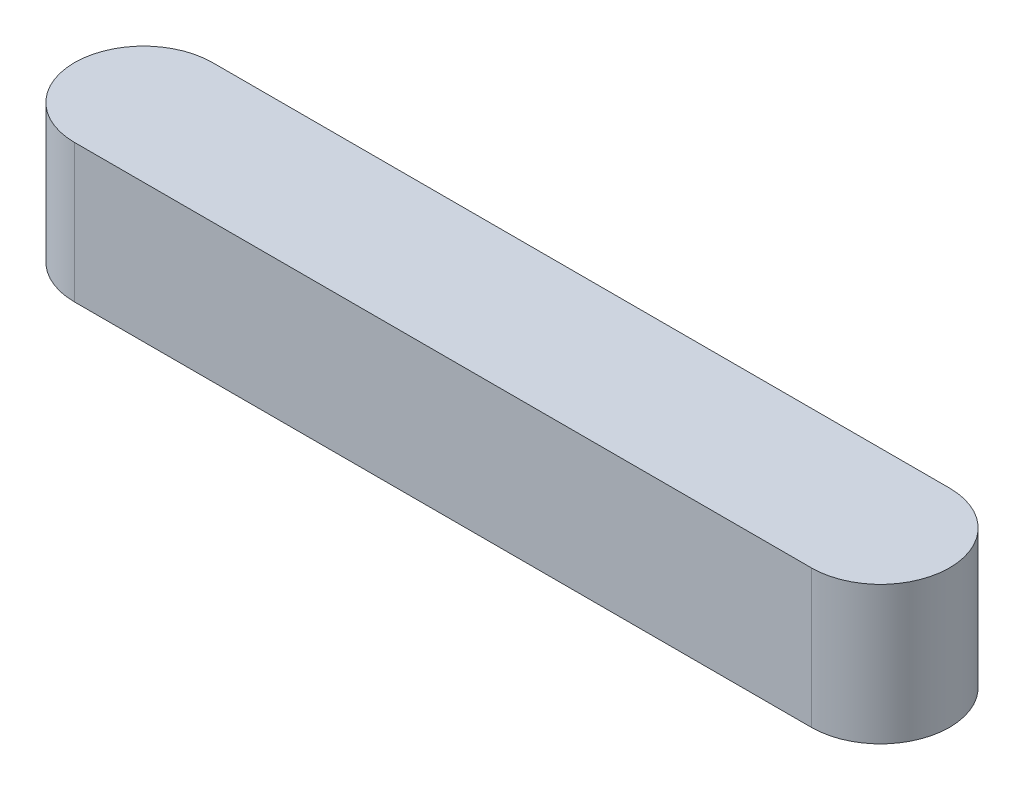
SolidWorks part; units mm, degrees
ref_plane "Plan de face" through (0, 0, 0) normal (0, 0, 1) x (1, 0, 0)
ref_plane "Plan de dessus" through (0, 0, 0) normal (0, 1, 0) x (1, 0, 0)
ref_plane "Plan de droite" through (0, 0, 0) normal (1, 0, 0) x (0, 0, -1)
sketch "Esquisse1" plane through (0, 0, 0) normal (0, 1, 0) x (1, 0, 0)
  line L0 (0, 3) -> (32, 3)
  line L1 (0, -3) -> (32, -3)
  arc A0 (0, 3) -> (0, -3) centre (0, 0) ccw
  arc A1 (32, -3) -> (32, 3) centre (32, 0) ccw
  dimension "D1" = 6
  dimension "D2" = 32
extrude "Extrusion1" add sketch "Esquisse1" along normal blind 6
